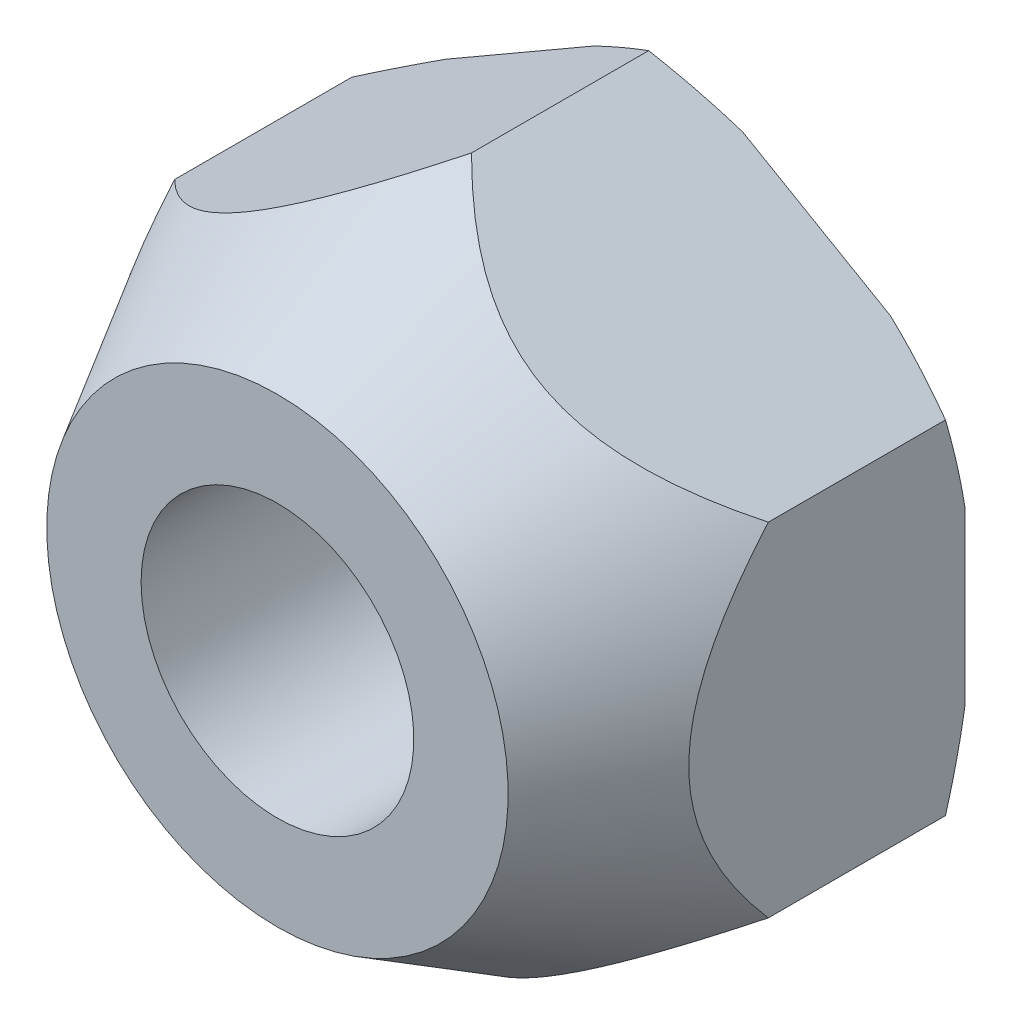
SolidWorks part; units mm, degrees
ref_plane "Front Plane" through (0, 0, 0) normal (0, 0, 1) x (1, 0, 0)
ref_plane "Top Plane" through (0, 0, 0) normal (0, 1, 0) x (1, 0, 0)
ref_plane "Right Plane" through (0, 0, 0) normal (1, 0, 0) x (0, 0, -1)
sketch "BaseNutSke" plane through (0, 0, 0) normal (1, 0, 0) x (0, 0, -1)
  line L0 (0, 0) -> (-14349.029, 0) construction
  line L1 (-7.3152, 2.5527) -> (-7.3152, 5.5562)
  line L2 (-7.3152, 5.5562) -> (0, 5.5562)
  line L6 (0, 5.5562) -> (0, 2.5527)
  line L7 (0, 2.5527) -> (-7.3152, 2.5527)
revolve "BaseNut" add sketch "BaseNutSke" angle 360 about L0
sketch "HexSke" plane through (0, 0, 0) normal (0, 0, 1) x (1, 0, 0)
  line L1 (5.5562, -3.2079) -> (5.5562, 3.2079)
  line L2 (5.5562, 3.2079) -> (0, 6.4158)
  line L3 (0, 6.4158) -> (-5.5563, 3.2079)
  line L4 (-5.5563, 3.2079) -> (-5.5563, -3.2079)
  line L5 (-5.5563, -3.2079) -> (0, -6.4158)
  line L6 (0, -6.4158) -> (5.5562, -3.2079)
  circle A0 centre (0, 0) radius 5.5562 construction
  circle A1 centre (0, 0) radius 5.5562 construction
  circle A3 centre (0, 0) radius 2.5527 construction
  circle A4 centre (0, 0) radius 2.5527
extrude "Hex" add sketch "HexSke" along normal up to surface (7.3152 mm away)
sketch "FilletSke" plane through (0, 0, 0) normal (1, 0, 0) x (0, 0, -1)
  line L0 (-7.3152, 6.4158) -> (-7.3152, 4.3188)
  line L2 (-7.3152, 4.3188) -> (-3.683, 6.4158)
  line L3 (-7.3152, 6.4158) -> (0, 6.4158) construction
  line L4 (-3.683, 6.4158) -> (-7.3152, 6.4158)
  line L5 (-7.3152, 6.4158) -> (-7.3152, 3.2079) construction
  line L6 (0, 3.2079) -> (0, 6.4158) construction
  line L7 (-0.3666, 6.4158) -> (0, 6.4158)
  line L8 (-7.3152, 6.4158) -> (0, 6.4158) construction
  line L9 (0, 6.4158) -> (0, 5.7808)
  line L10 (0, 5.7808) -> (-0.3666, 6.4158)
  line L14 (0, 0) -> (-50000, 0) construction
revolve "HexFillet" cut sketch "FilletSke" angle 360 about L14
sketch "ThdSchSke" plane through (0, 0, 0) normal (1, 0, 0) x (0, 0, -1)
  line L0 (-0.3593, 2.5527) -> (0, 3.175)
  line L1 (0, 3.175) -> (0.3593, 2.5527)
  line L2 (0.3593, 2.5527) -> (-0.3593, 2.5527)
  line L3 (0, 2.6384) -> (0, 50002.6384) construction
  line L4 (0, 1.5956) -> (0, 4.0141) construction
  line L6 (0, 2.5527) -> (-7.3152, 2.5527) construction
  line L8 (0, 0) -> (-50000, 0) construction
revolve "ThreadSchematic" cut sketch "ThdSchSke" angle 360 about L8
pattern_linear "ThdSchPat" [suppressed] count 11
equation "\"D1@ThdSchPat\" =  ( \"C@BaseNutSke\" / \"D3@ThdSchSke\" )  + 1"
equation "\"D3@FilletSke\"=\"ThreadSize@ThdSchSke\" * .1"
